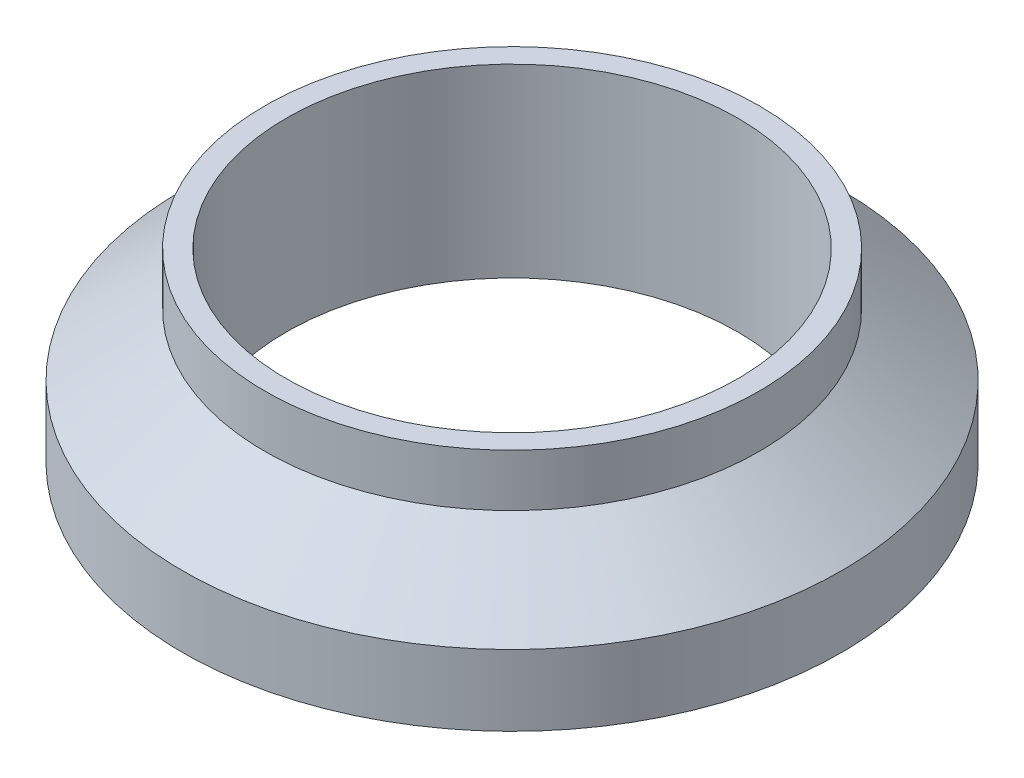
SolidWorks part; units mm, degrees
ref_plane "Front Plane" through (0, 0, 0) normal (0, 0, 1) x (1, 0, 0)
ref_plane "Top Plane" through (0, 0, 0) normal (0, 1, 0) x (1, 0, 0)
ref_plane "Right Plane" through (0, 0, 0) normal (1, 0, 0) x (0, 0, -1)
sketch "Sketch1" plane through (0, 0, 0) normal (0, 0, 1) x (1, 0, 0)
  line L0 (-17.399, 0) -> (-17.399, 14.2748)
  line L1 (-17.399, 14.2748) -> (-19.05, 14.2748)
  line L2 (-19.05, 14.2748) -> (-19.05, 10.2461)
  line L3 (-19.05, 10.2461) -> (-25.4, 5.461)
  line L4 (-25.4, 5.461) -> (-25.4, 0)
  line L5 (-25.4, 0) -> (-23.3466, 0)
  line L6 (-17.399, 0) -> (-20.2906, 0)
  line L7 (0, 0) -> (0, 37.9334) construction
  arc A0 (-20.2906, 0) -> (-23.3466, 0) centre (-21.8186, -0.381) ccw
  dimension "D1" = 3.1496
  dimension "D2" = 17.399
  dimension "D3" = 19.05
  dimension "D4" = 21.8186
  dimension "D5" = 25.4
  dimension "D6" = 5.461
  dimension "D7" = 14.2748
  dimension "D8" = 127
  dimension "D9" = 0.381
revolve "Revolve1" add sketch "Sketch1" angle 360 about L7
